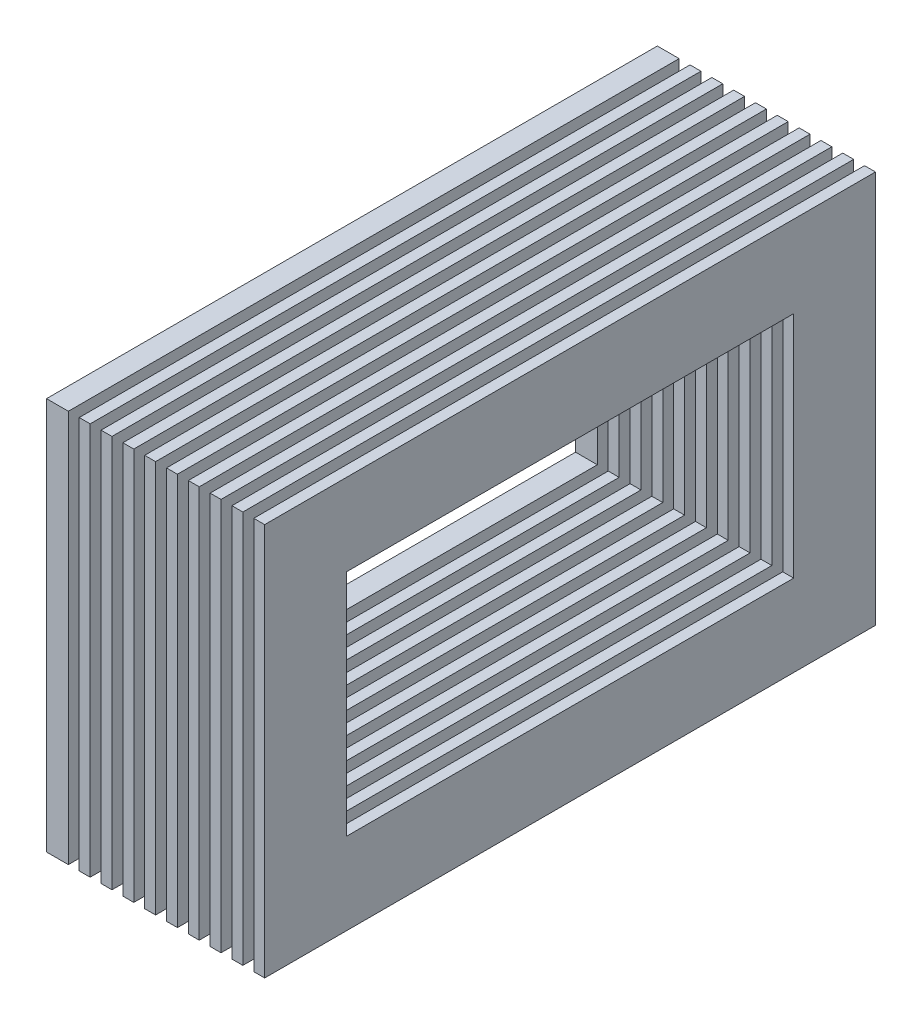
SolidWorks part; units mm, degrees
ref_plane "前视基准面" through (0, 0, 0) normal (0, 0, 1) x (1, 0, 0)
ref_plane "上视基准面" through (0, 0, 0) normal (0, 1, 0) x (1, 0, 0)
ref_plane "右视基准面" through (0, 0, 0) normal (1, 0, 0) x (0, 0, -1)
sketch "Sketch2" plane through (0, 0, 0) normal (0, 1, 0) x (1, 0, 0)
  line L1 (-1, -2.8) -> (1, -2.8)
  line L2 (-1, -2.8) -> (-1, 2.8)
  line L3 (-1, 2.8) -> (1, 2.8)
  line L4 (1, -2.8) -> (1, 2.8)
  line L5 (-1, -2.8) -> (1, 2.8) construction
  line L6 (-1, 2.8) -> (1, -2.8) construction
  point P0 (0, 0)
  point P6 (0, 0)
  dimension "D1" = 5.6
  dimension "D2" = 2
extrude "Boss-Extrude1" add sketch "Sketch2" along normal blind 3.6
sketch "Sketch3" plane through (-1, 0, 0) normal (-1, 0, 0) x (0, 0, 1)
  line L0 (2.8, 3.6) -> (2.8, 0) construction
  line L1 (2.05, 0.75) -> (-2.05, 0.75)
  line L2 (2.05, 0.75) -> (2.05, 2.85)
  line L3 (2.05, 2.85) -> (-2.05, 2.85)
  line L4 (-2.05, 0.75) -> (-2.05, 2.85)
  line L5 (2.05, 0.75) -> (-2.05, 2.85) construction
  line L6 (2.05, 2.85) -> (-2.05, 0.75) construction
  line L7 (-2.8, 3.6) -> (-2.8, 0) construction
  line L8 (-2.8, 3.6) -> (2.8, 3.6) construction
  point P0 (0, 1.8)
  point P8 (2.8, 1.8)
  dimension "D1" = 0.75
  dimension "D2" = 0.75
extrude "Cut-Extrude1" cut sketch "Sketch3" against normal through all
ref_plane "Plane1" through (-0.8, 0, 0) normal (-1, 0, 0) x (0, 0, 1)
sketch "Sketch4" plane through (-0.8, 0, 0) normal (-1, 0, 0) x (0, 0, 1)
  line L1 (6.7213, -1.565) -> (-6.7213, -1.565)
  line L2 (6.7213, -1.565) -> (6.7213, 6.7983)
  line L3 (6.7213, 6.7983) -> (-6.7213, 6.7983)
  line L4 (-6.7213, -1.565) -> (-6.7213, 6.7983)
  line L5 (6.7213, -1.565) -> (-6.7213, 6.7983) construction
  line L6 (6.7213, 6.7983) -> (-6.7213, -1.565) construction
  point P0 (0, 2.6166)
extrude "Cut-Extrude2" cut sketch "Sketch4" against normal blind 0.1
pattern_linear "LPattern1" count 108 spacing 0.2 along (1, 0, 0) of "Cut-Extrude2"
